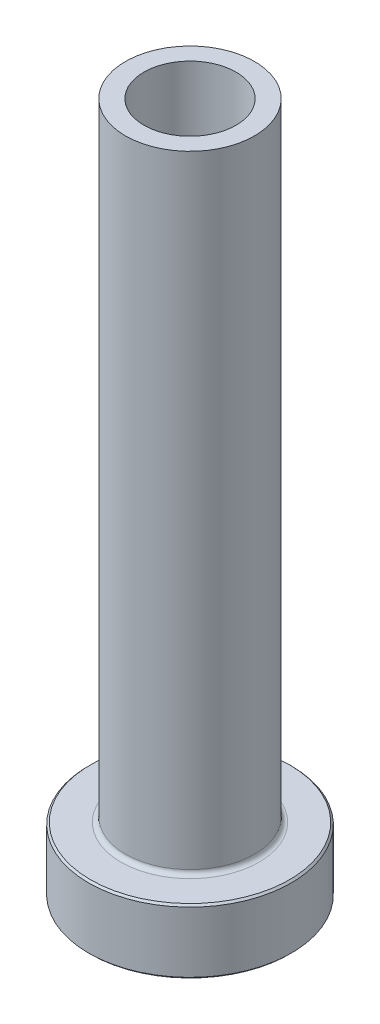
SolidWorks part; units mm, degrees
ref_plane "Front Plane" through (0, 0, 0) normal (0, 0, 1) x (1, 0, 0)
ref_plane "Top Plane" through (0, 0, 0) normal (0, 1, 0) x (1, 0, 0)
ref_plane "Right Plane" through (0, 0, 0) normal (1, 0, 0) x (0, 0, -1)
sketch "Sketch1" plane through (0, 0, 0) normal (0, 0, 1) x (1, 0, 0)
  line L0 (-5, 75) -> (-7, 75)
  line L1 (-7, 75) -> (-7, 7)
  line L2 (-7, 7) -> (-11, 7)
  line L3 (-11, 7) -> (-11, 0)
  line L4 (12.1, 0) -> (-12.1, 0) construction
  line L5 (-11, 0) -> (-5.25, 0)
  line L6 (-5, 30) -> (-5, 75)
  line L7 (0, 92.1877) -> (0, -15.5353) construction
  line L8 (0, -12.1) -> (0, 12.1) construction
  line L9 (-5, 30) -> (-5.25, 18)
  line L10 (-5.25, 18) -> (-5.25, 0)
  dimension "D1" = 0.25
  dimension "ID" = 10
  dimension "OD" = 14
  dimension "L" = 75
  dimension "H" = 22
  dimension "T" = 7
  dimension "N" = 45
  dimension "D2" = 12
revolve "Revolve1" add sketch "Sketch1" angle 360 about L7
fillet "Fillet1" radius 0.5 1 edges at (0, 7, 7)
chamfer "Chamfer1" distance 0.2 angle 45 2 edges at (0, 7, 11) (0, 0, 11)
chamfer "Chamfer3" distance 0.5 angle 45 1 edges at (0, 0, 5.25)
